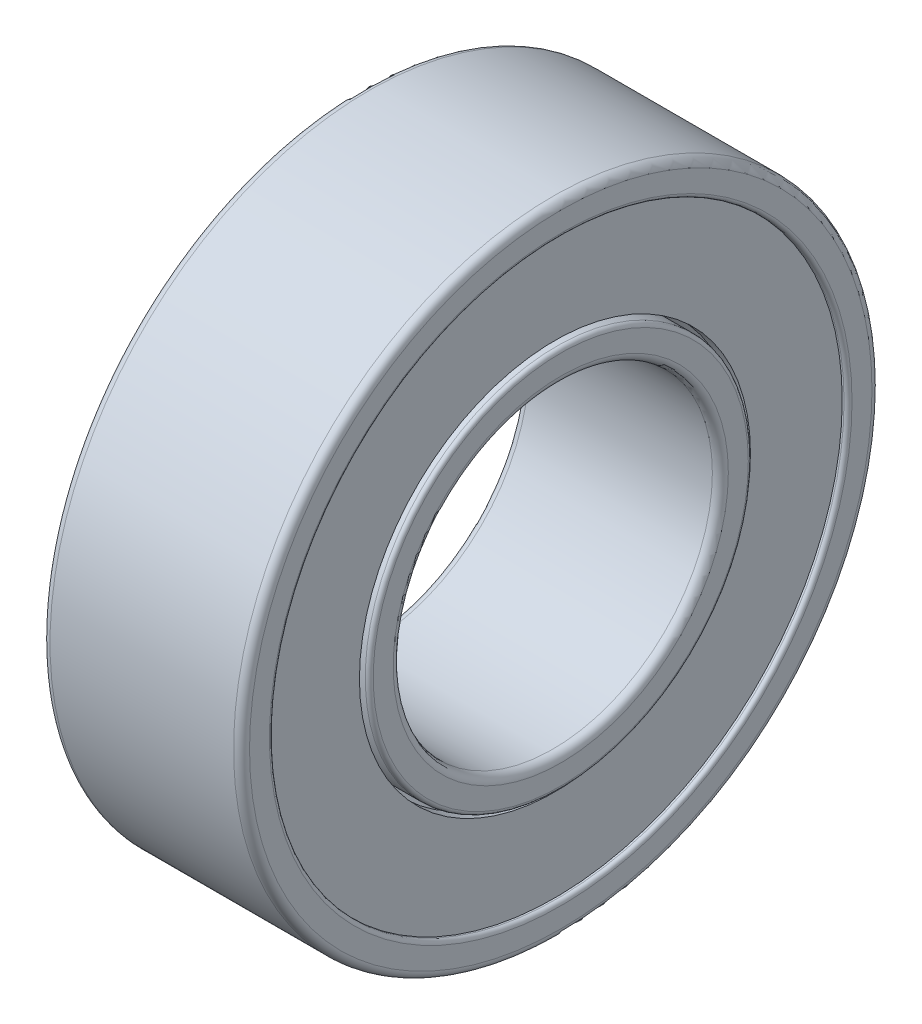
SolidWorks part; units mm, degrees
ref_plane "Спереди" through (0, 0, 0) normal (0, 0, 1) x (1, 0, 0)
ref_plane "Сверху" through (0, 0, 0) normal (0, 1, 0) x (1, 0, 0)
ref_plane "Справа" through (0, 0, 0) normal (1, 0, 0) x (0, 0, -1)
sketch "Эскиз1" plane through (0, 0, 0) normal (0, 0, 1) x (1, 0, 0)
  line L0 (0, 0) -> (-19.2603, 0) construction
  line L1 (0, 0) -> (0, 4) construction
  line L2 (2.3, 8) -> (-2.3, 8)
  line L3 (-2.5, 7.8) -> (-2.5, 7.3)
  line L4 (-2.4, 7.2) -> (-2.3542, 7.2)
  line L5 (-2.3542, 7.2) -> (-2.3542, 4.9)
  line L6 (-2.3542, 4.9) -> (-2.0431, 4.9)
  line L7 (-2.0431, 4.9) -> (-2.0431, 7.2)
  line L8 (-2.0431, 7.2) -> (-1.3038, 7.2)
  line L9 (2.5, 4.7) -> (2.5, 4.2)
  line L10 (-1.2083, 4.8) -> (-2.4, 4.8)
  line L11 (-2.5, 4.7) -> (-2.5, 4.2)
  line L12 (-2.3, 4) -> (2.3, 4)
  line L13 (0, 8) -> (0, 13.3474) construction
  line L14 (1.2083, 4.8) -> (2.4, 4.8)
  line L15 (2.0431, 7.2) -> (1.3038, 7.2)
  line L16 (2.0431, 4.9) -> (2.0431, 7.2)
  line L17 (2.3542, 4.9) -> (2.0431, 4.9)
  line L18 (2.3542, 7.2) -> (2.3542, 4.9)
  line L19 (2.4, 7.2) -> (2.3542, 7.2)
  line L20 (2.5, 7.8) -> (2.5, 7.3)
  arc A0 (-1.3038, 7.2) -> (-1.2083, 4.8) centre (0, 6.05) ccw
  arc A1 (1.3038, 7.2) -> (1.2083, 4.8) centre (0, 6.05) cw
  arc A2 (2.5, 4.2) -> (2.3, 4) centre (2.3, 4.2) cw
  arc A3 (-2.5, 4.2) -> (-2.3, 4) centre (-2.3, 4.2) ccw
  arc A4 (2.5, 7.8) -> (2.3, 8) centre (2.3, 7.8) ccw
  arc A5 (-2.3, 8) -> (-2.5, 7.8) centre (-2.3, 7.8) ccw
  arc A6 (2.5, 4.7) -> (2.4, 4.8) centre (2.4, 4.7) ccw
  arc A7 (2.4, 7.2) -> (2.5, 7.3) centre (2.4, 7.3) ccw
  arc A8 (-2.5, 7.3) -> (-2.4, 7.2) centre (-2.4, 7.3) ccw
  arc A9 (-2.4, 4.8) -> (-2.5, 4.7) centre (-2.4, 4.7) ccw
  point P29 (2.5, 4)
  point P32 (-2.5, 4)
  point P35 (2.5, 8)
  point P38 (-2.5, 8)
  point P41 (2.5, 4.8)
  point P44 (2.5, 7.2)
  point P47 (-2.5, 7.2)
  point P50 (-2.5, 4.8)
  point P51 (-2.0431, 6.05)
  dimension "D6" = 0.2
  dimension "D7" = 0.1
  dimension "D1" = 16
  dimension "D2" = 8
  dimension "D3" = 0.8
  dimension "D4" = 0.8
  dimension "D5" = 5
  dimension "D8" = 0.1
revolve "Повернуть1" add sketch "Эскиз1" angle 360 about L0
